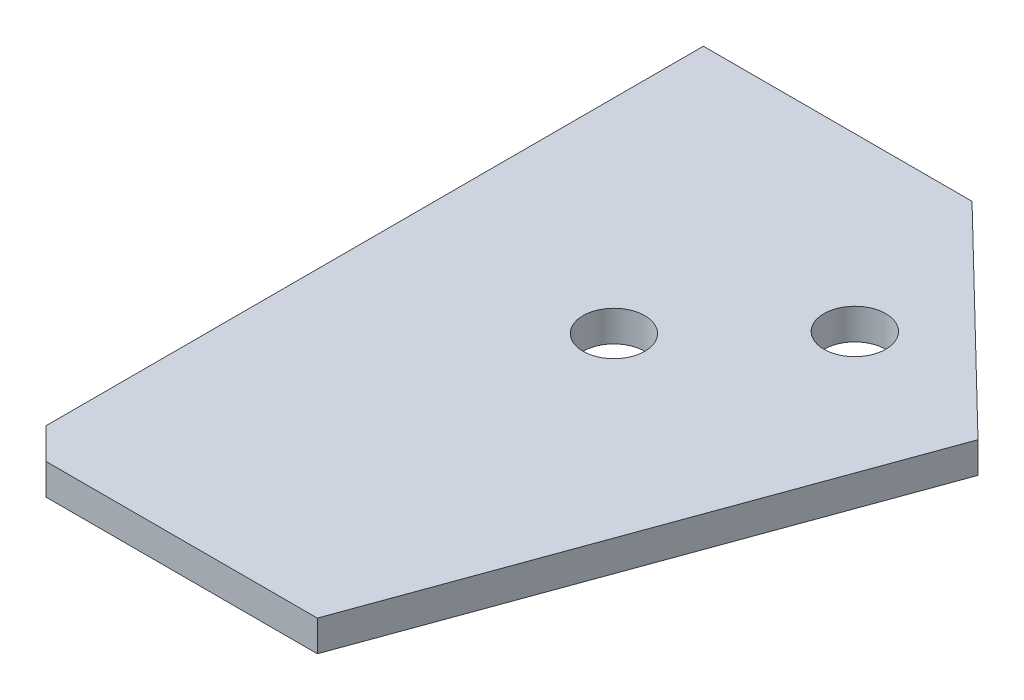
SolidWorks part; units mm, degrees
ref_plane "Front Plane" through (0, 0, 0) normal (0, 0, 1) x (1, 0, 0)
ref_plane "Top Plane" through (0, 0, 0) normal (0, 1, 0) x (1, 0, 0)
ref_plane "Right Plane" through (0, 0, 0) normal (1, 0, 0) x (0, 0, -1)
sketch "Sketch1" plane through (0, 0, 0) normal (0, 1, 0) x (1, 0, 0)
  line L0 (124.2, 0) -> (196.4513, 199.2075)
  line L1 (0, 0) -> (124.2, 0)
  line L2 (0, 0) -> (0, 282.8238)
  line L3 (110.3797, 282.8238) -> (0, 282.8238)
  line L4 (110.3797, 282.8238) -> (196.4513, 199.2075)
  dimension "D1" = 124.2
  dimension "D2" = 282.8238
  dimension "D3" = 110.3797
  dimension "D4" = 211.9054
extrude "Boss-Extrude1" add sketch "Sketch1" along normal mid plane 12.7
sketch "Brace Centre Line Sketch" plane through (0, 0, 0) normal (0, 1, 0) x (1, 0, 0)
  line L0 (-79, -5.4) -> (269.4012, 353.2315)
  line L1 (196.4513, 199.2075) -> (110.3797, 282.8238) construction
  dimension "D1" = 500
sketch "Hole Centres Sketch" plane through (0, 6.35, 0) normal (0, 1, 0) x (1, 0, 0)
  line L0 (83.8376, 162.2191) -> (132.6137, 212.4275) construction
  line L1 (83.8376, 162.2191) -> (59.4495, 137.1148) construction
  line L2 (132.6137, 212.4275) -> (157.0018, 237.5317) construction
  line L5 (-79, -5.4) -> (269.4012, 353.2315) construction
  line L7 (196.4513, 199.2075) -> (110.3797, 282.8238) construction
  dimension "D1" = 35
  dimension "D2" = 70
  dimension "D3" = 35
hole_wizard "1 (1) Diameter Hole1" positions "Sketch4" profile "Sketch3" hole size "1" standard "ANSI Inch"
sketch "Sketch4" plane through (0, 6.35, 0) normal (0, 1, 0) x (-1, 0, 0)
  point P0 (-132.6137, -212.4275)
  point P4 (-83.8376, -162.2191)
sketch "Sketch3" plane through (132.6137, 6.35, -212.4275) normal (1, 0, 0) x (0, 0, 1)
  line L0 (0, 0) -> (0, 12.7)
  line L1 (0, 12.7) -> (12.7, 12.7)
  line L2 (12.7, 12.7) -> (12.7, 0)
  line L5 (12.7, 0) -> (0, 0)
  line L11 (0, -6.35) -> (0, 107.95) construction
  dimension "Thru Hole Dia." = 25.4
  dimension "Thru Hole Depth" = 12.7
chamfer "Chamfer2" distance 12.7 angle 45 1 edges at (0, 0, 0)
